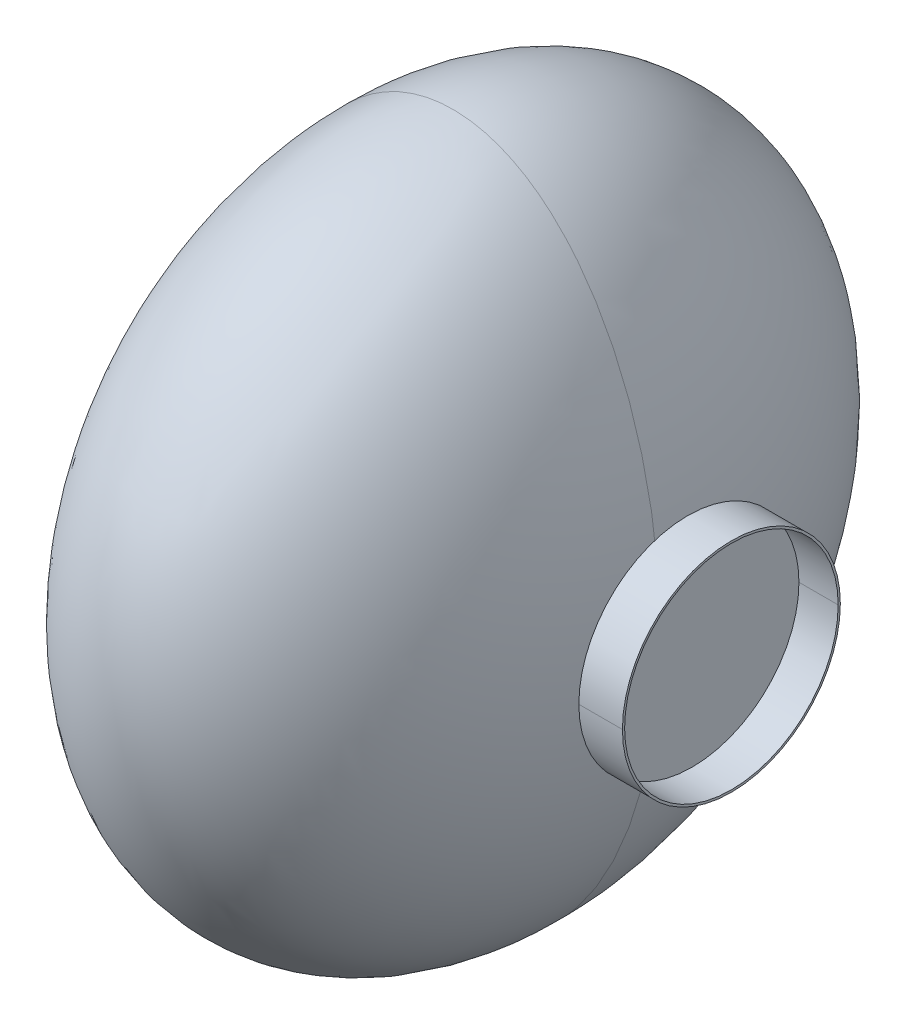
SolidWorks part; units mm, degrees
ref_plane "Alzado" through (0, 0, 0) normal (0, 0, 1) x (1, 0, 0)
ref_plane "Planta" through (0, 0, 0) normal (0, 1, 0) x (1, 0, 0)
ref_plane "Vista lateral" through (0, 0, 0) normal (1, 0, 0) x (0, 0, -1)
imported_body "TOULON_A1365.STEP-1/OVALO.STEP-1-solid1"
imported_body "TOULON_A1365.STEP-1/tubo ison 155.STEP-1-solid1"
imported_body "TOULON_A1365.STEP-1/FLORON 100.STEP-1-solid1"
sketch "Croquis1" plane through (-115.4599, 0, 0) normal (-1, 0, 0) x (0, 0, 1)
  circle A0 centre (-2.6506, -3.2371) radius 31
extrude "Cortar-Extruir1" cut sketch "Croquis1" against normal blind 12
sketch "Croquis2" plane through (-103.4599, 0, 0) normal (-1, 0, 0) x (0, 0, 1)
  circle A0 centre (-2.6506, -3.2371) radius 31
extrude "Saliente-Extruir1" add sketch "Croquis2" along normal blind 2 draft 45 separate body
sketch "Croquis3" plane through (-105.4599, 0, 0) normal (-1, 0, 0) x (0, 0, 1)
  circle A0 centre (-2.6506, -3.2371) radius 25.8248
extrude "Saliente-Extruir2" add sketch "Croquis3" along normal blind 3
